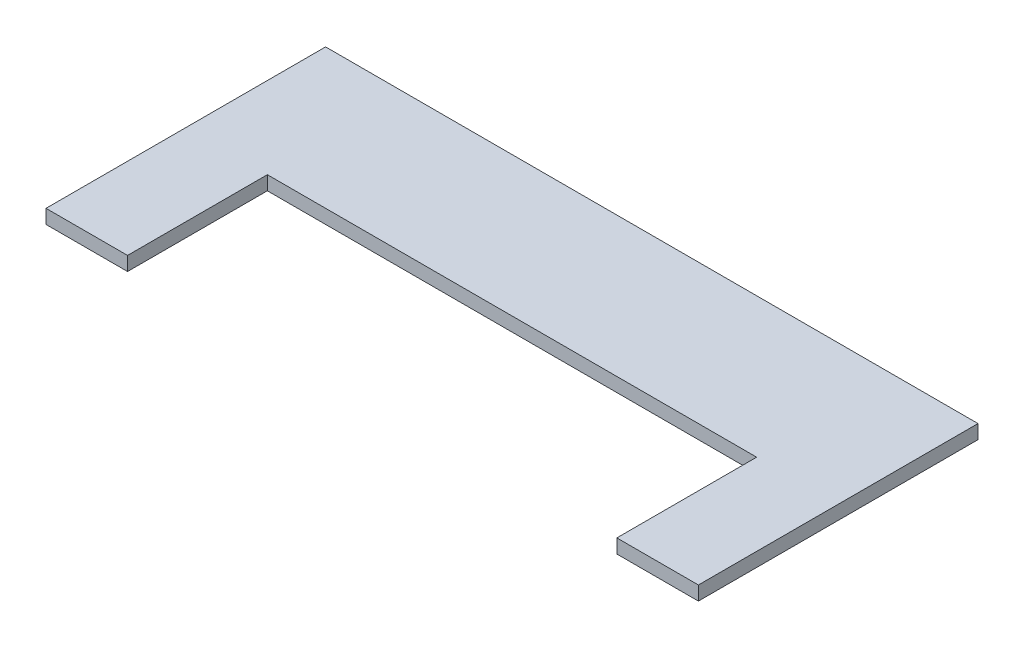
SolidWorks part; units mm, degrees
ref_plane "Front Plane" through (0, 0, 0) normal (0, 0, 1) x (1, 0, 0)
ref_plane "Top Plane" through (0, 0, 0) normal (0, 1, 0) x (1, 0, 0)
ref_plane "Right Plane" through (0, 0, 0) normal (1, 0, 0) x (0, 0, -1)
sketch "Sketch1" plane through (0, 0, 0) normal (0, 1, 0) x (1, 0, 0)
  line L0 (0, 0) -> (0, 120)
  line L1 (0, 120) -> (280, 120)
  line L2 (280, 120) -> (280, 0)
  line L3 (280, 0) -> (245, 0)
  line L4 (245, 0) -> (245, 60)
  line L5 (0, 0) -> (35, 0)
  line L6 (35, 0) -> (35, 60)
  line L7 (35, 60) -> (245, 60)
extrude "Boss-Extrude1" add sketch "Sketch1" along normal blind 6
